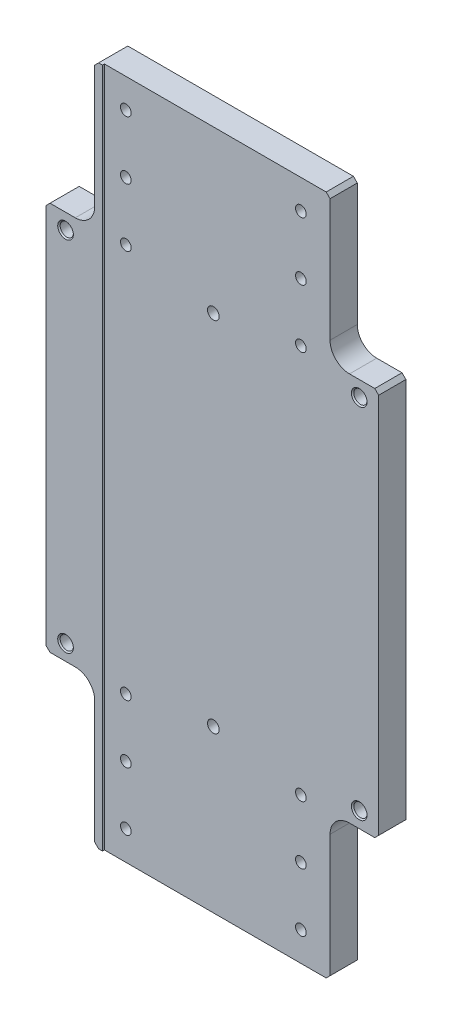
SolidWorks part; units mm, degrees
ref_plane "정면" through (0, 0, 0) normal (0, 0, 1) x (1, 0, 0)
ref_plane "윗면" through (0, 0, 0) normal (0, 1, 0) x (1, 0, 0)
ref_plane "우측면" through (0, 0, 0) normal (1, 0, 0) x (0, 0, -1)
sketch "스케치1" plane through (0, 0, 0) normal (0, 0, 1) x (1, 0, 0)
  line L0 (60, 100) -> (85, 100)
  line L1 (-60, 175) -> (60, 175)
  line L2 (-60, 175) -> (-60, 100)
  line L3 (-60, -175) -> (60, -175)
  line L4 (60, 175) -> (60, 100)
  line L5 (-60, 175) -> (60, -175) construction
  line L6 (-60, -175) -> (60, 175) construction
  line L7 (85, 100) -> (85, -100)
  line L8 (85, -100) -> (60, -100)
  line L9 (-60, 100) -> (-85, 100)
  line L10 (-85, 100) -> (-85, -100)
  line L11 (-85, -100) -> (-60, -100)
  line L12 (-60, -100) -> (-60, -175)
  line L13 (60, -100) -> (60, -175)
  point P0 (0, 0)
  dimension "D1" = 200
  dimension "D2" = 75
  dimension "D3" = 75
  dimension "D4" = 120
  dimension "D5" = 25
  dimension "D6" = 25
extrude "보스-돌출1" add sketch "스케치1" along normal mid plane 15
sketch "스케치2" plane through (0, 0, 7.5) normal (0, 0, 1) x (1, 0, 0)
  line L0 (60, 175) -> (-60, 175) construction
  line L1 (-56, 175) -> (85, 175)
  line L2 (-56, 175) -> (-56, -175)
  line L3 (-56, -175) -> (85, -175)
  line L4 (85, 175) -> (85, -175)
  line L5 (85, -100) -> (85, 100) construction
  line L6 (-60, -175) -> (60, -175) construction
  line L7 (-85, 100) -> (-85, -100) construction
  dimension "D1" = 29
extrude "컷-돌출1" cut sketch "스케치2" against normal blind 1
hole_wizard "M5 소켓 머리 캡 나사용 카운터보어1" positions "스케치5" profile "스케치6" counterbore size "M5" standard "KS"
sketch "스케치5" plane through (0, 0, -7.5) normal (0, 0, -1) x (-1, 0, 0)
  line L0 (-60, 100) -> (-60, 175) construction
  line L1 (-60, 175) -> (60, 175) construction
  point P0 (-45, 160)
  point P2 (45, 160)
  point P4 (-45, 130)
  point P6 (45, 130)
  point P8 (-45, 100)
  point P10 (45, 100)
  dimension "D1" = 15
  dimension "D2" = 90
  dimension "D3" = 15
  dimension "D4" = 30
  dimension "D5" = 30
sketch "스케치6" plane through (45, 160, -7.5) normal (1, 0, 0) x (0, 1, 0)
  line L0 (0, 0) -> (0, 15)
  line L1 (0, 15) -> (2.75, 15)
  line L3 (2.75, 15) -> (2.75, 7)
  line L4 (2.75, 7) -> (4.75, 7)
  line L5 (4.75, 7) -> (4.75, 0)
  line L7 (4.75, 0) -> (0, 0)
  line L11 (0, -6.35) -> (0, 107.95) construction
  dimension "관통 구멍 지름" = 5.5
  dimension "관통 구멍 깊이" = 15
  dimension "카운터보어 지름" = 9.5
  dimension "카운터보어 깊이" = 7
pattern_linear "선형 패턴1" count 2 spacing 260 along (0, -1, 0) of "M5 소켓 머리 캡 나사용 카운터보어1"
hole_wizard "Ø6.0mm 맞춤핀 구멍1" positions "스케치7" profile "스케치8" hole size "Ø6.0" standard "ISO"
sketch "스케치7" plane through (0, 0, 6.5) normal (0, 0, 1) x (1, 0, 0)
  line L0 (0, 0) -> (0, 187.9174) construction
  line L1 (60, 175) -> (-56, 175) construction
  point P6 (0, 92)
  point P8 (0, -92)
  dimension "D1" = 184
  dimension "D2" = 83
sketch "스케치8" plane through (0, -92, 6.5) normal (1, 0, 0) x (0, -1, 0)
  line L0 (0, 0) -> (0, 14)
  line L1 (0, 14) -> (3, 14)
  line L2 (3, 14) -> (3, 0)
  line L5 (3, 0) -> (0, 0)
  line L11 (0, -6.35) -> (0, 107.95) construction
  dimension "관통 구멍 지름" = 6
  dimension "관통 구멍 깊이" = 14
fillet "필렛1" radius 10 4 edges at (60, -100, -0.5) (-60, -100, 0) (-60, 100, 0) (60, 100, -0.5)
chamfer "모따기1" distance 2 angle 45 8 edges at (-85, 100, 0) (-60, 175, 0) (-85, -100, 0) (-60, -175, 0) (60, -175, -0.5) (85, -100, -0.5) (85, 100, -0.5) (60, 175, -0.5)
hole_wizard "M8 나사 구멍2" positions "스케치9" profile "스케치10" tap size "M8" standard "ISO"
sketch "스케치9" plane through (0, 0, 6.5) normal (0, 0, 1) x (1, 0, 0)
  line L0 (85, -98) -> (85, 98) construction
  line L1 (58, 175) -> (-56, 175) construction
  point P0 (75, 92)
  point P2 (75, -92)
  dimension "D2" = 10
  dimension "D3" = 184
  dimension "D4" = 83
sketch "스케치10" plane through (75, 92, 6.5) normal (1, 0, 0) x (0, -1, 0)
  line L0 (0, 0) -> (0, 14)
  line L1 (0, 14) -> (4.025, 14)
  line L2 (3.4, 13.375) -> (3.4, 0.625)
  line L3 (3.4, 0.625) -> (4.025, 0)
  line L5 (4.025, 0) -> (0, 0)
  line L6 (-3.4, 0.625) -> (-4.025, 0) construction
  line L7 (4.025, 14) -> (3.4, 13.375)
  line L8 (-4.025, 14) -> (-3.4, 13.375) construction
  line L11 (0, -6.35) -> (0, 107.95) construction
  dimension "관통 탭 드릴 지름" = 6.8
  dimension "관통 탭 드릴 깊이" = 14
  dimension "표면 카운터싱크 지름" = 8.05
  dimension "표면 카운터싱크 각도" = 90
  dimension "안쪽면 카운터싱크 지름" = 8.05
  dimension "안쪽면 카운터싱크 각도" = 90
hole_wizard "M8 나사 구멍3" positions "스케치11" profile "스케치12" tap size "M8" standard "ISO"
sketch "스케치11" plane through (0, 0, 7.5) normal (0, 0, 1) x (1, 0, 0)
  line L0 (58, 175) -> (-56, 175) construction
  line L1 (-85, 98) -> (-85, -98) construction
  point P0 (-75, 92)
  point P2 (-75, -92)
  dimension "D1" = 184
  dimension "D2" = 83
  dimension "D3" = 10
sketch "스케치12" plane through (-75, 92, 7.5) normal (1, 0, 0) x (0, -1, 0)
  line L0 (0, 0) -> (0, 15)
  line L1 (0, 15) -> (4.025, 15)
  line L2 (3.4, 14.375) -> (3.4, 0.625)
  line L3 (3.4, 0.625) -> (4.025, 0)
  line L5 (4.025, 0) -> (0, 0)
  line L6 (-3.4, 0.625) -> (-4.025, 0) construction
  line L7 (4.025, 15) -> (3.4, 14.375)
  line L8 (-4.025, 15) -> (-3.4, 14.375) construction
  line L11 (0, -6.35) -> (0, 107.95) construction
  dimension "관통 탭 드릴 지름" = 6.8
  dimension "관통 탭 드릴 깊이" = 15
  dimension "표면 카운터싱크 지름" = 8.05
  dimension "표면 카운터싱크 각도" = 90
  dimension "안쪽면 카운터싱크 지름" = 8.05
  dimension "안쪽면 카운터싱크 각도" = 90
